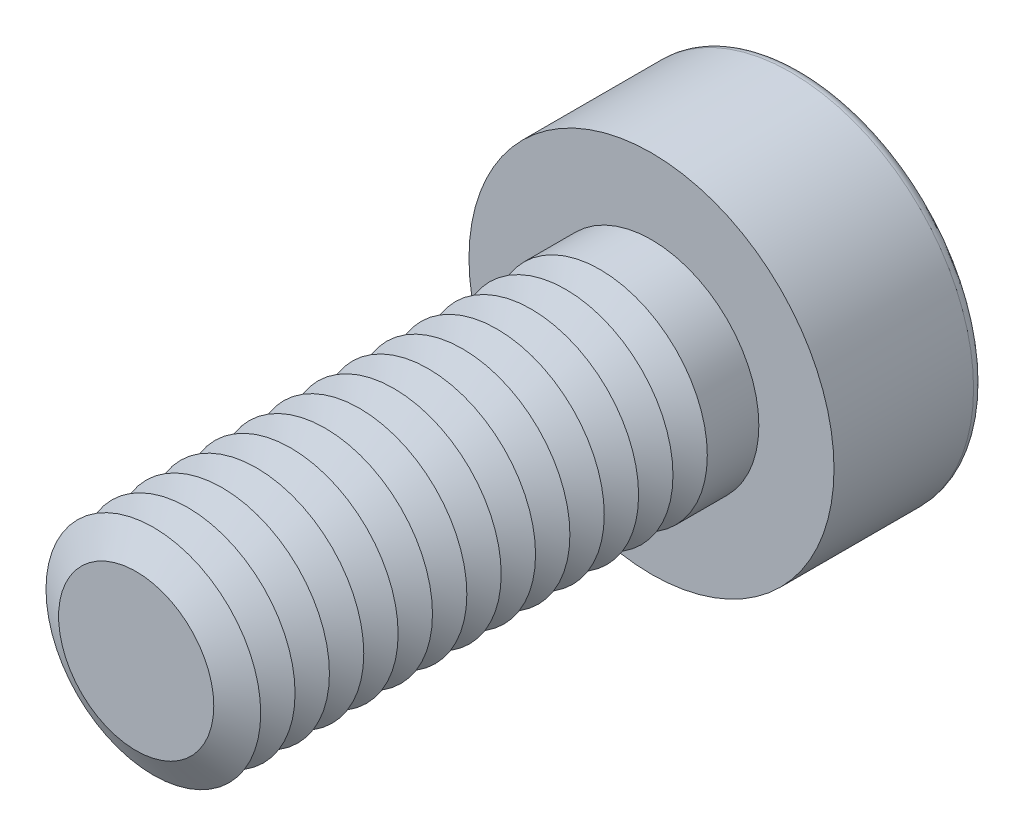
SolidWorks part; units mm, degrees
ref_plane "Front Plane" through (0, 0, 0) normal (0, 0, 1) x (1, 0, 0)
ref_plane "Top Plane" through (0, 0, 0) normal (0, 1, 0) x (1, 0, 0)
ref_plane "Right Plane" through (0, 0, 0) normal (1, 0, 0) x (0, 0, -1)
sketch "Sketch1" plane through (0, 0, 0) normal (0, 0, 1) x (1, 0, 0)
  circle A0 centre (0, 0) radius 2.5
  dimension "D1" = 5
extrude "Boss-Extrude1" add sketch "Sketch1" along normal blind 12
sketch "Sketch2" plane through (0, 0, 0) normal (0, 0, -1) x (-1, 0, 0)
  circle A0 centre (0, 0) radius 4.25
  dimension "D1" = 8.5
extrude "Boss-Extrude2" add sketch "Sketch2" along normal blind 3.5
sketch "Sketch3" plane through (0, 0, -3.5) normal (0, 0, -1) x (-1, 0, 0)
  line L1 (-0.866, 1.5) -> (-1.7321, 0)
  line L2 (-1.7321, 0) -> (-0.866, -1.5)
  line L3 (-0.866, -1.5) -> (0.866, -1.5)
  line L4 (0.866, -1.5) -> (1.7321, 0)
  line L5 (1.7321, 0) -> (0.866, 1.5)
  line L6 (0.866, 1.5) -> (-0.866, 1.5)
  circle A0 centre (0, 0) radius 1.5 construction
  dimension "D1" = 3
extrude "Cut-Extrude1" cut sketch "Sketch3" against normal blind 2.25
fillet "Fillet1" radius 0.25 1 edges at (-4.25, 0, -3.5)
sketch "Sketch4" plane through (0, 0, -1.25) normal (0, 0, -1) x (-1, 0, 0)
  line L0 (0.866, -1.5) -> (1.7321, 0) construction
  circle A0 centre (0, 0) radius 1.5
extrude "Cut-Extrude2" cut sketch "Sketch4" against normal through all draft 60
sketch "Sketch5" plane through (0, 0, -3.5) normal (0, 0, -1) x (-1, 0, 0)
  circle A0 centre (0, 0) radius 1.7321
extrude "Cut-Extrude3" cut sketch "Sketch5" against normal through all draft 75
sketch "Sketch7" plane through (0, 0, 0) normal (1, 0, 0) x (0, 0, -1)
  line L25 (-12, 1.8072) -> (-11.6, 2.5)
  line L26 (-12, 2.5) -> (-12, -2.5) construction
  line L27 (-11.6, 2.5) -> (-12.4, 2.5)
  line L28 (-12.4, 2.5) -> (-12, 1.8072)
  line L29 (0, 2.5) -> (-12, 2.5) construction
  dimension "D1" = 0.8
revolve "Cut-Revolve1" cut sketch "Sketch7" angle 360 about axis through (0, 0, 12) along (0, 0, -1)
pattern_linear "LPattern1" count 14 spacing 0.8 along (0, 0, -1) of "Cut-Revolve1"
